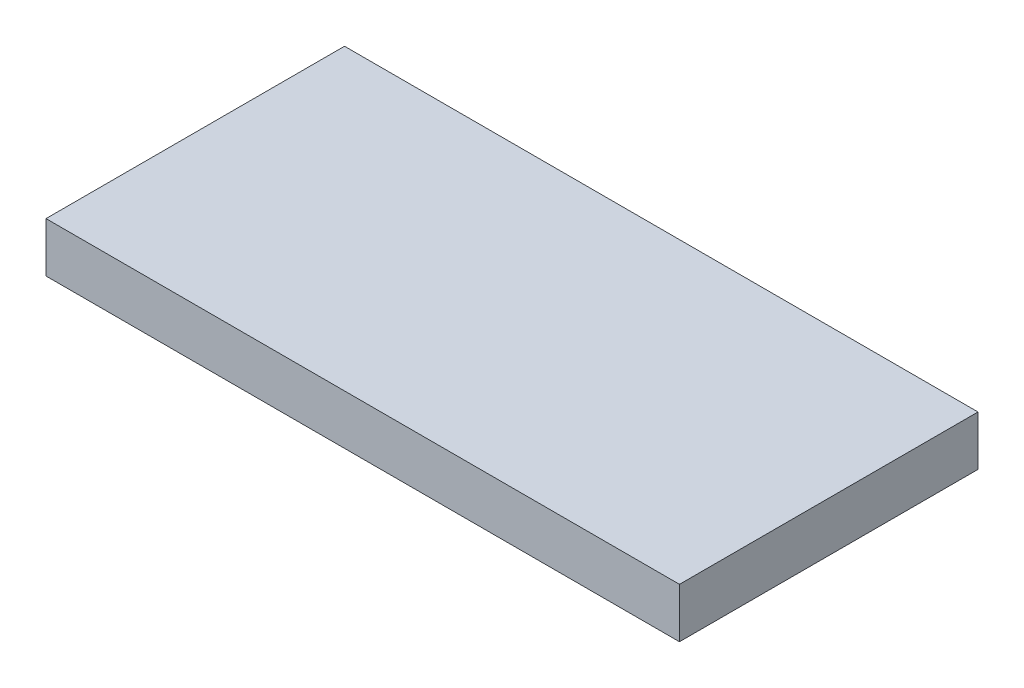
SolidWorks part; units mm, degrees
ref_plane "Front" through (0, 0, 0) normal (0, 0, 1) x (1, 0, 0)
ref_plane "Top" through (0, 0, 0) normal (0, 1, 0) x (1, 0, 0)
ref_plane "Right" through (0, 0, 0) normal (1, 0, 0) x (0, 0, -1)
sketch "Sketch1" plane through (0, 0, 0) normal (0, 1, 0) x (1, 0, 0)
  line L1 (-646.7996, 304.8) -> (646.7996, 304.8)
  line L2 (-646.7996, 304.8) -> (-646.7996, -304.8)
  line L3 (-646.7996, -304.8) -> (646.7996, -304.8)
  line L4 (646.7996, 304.8) -> (646.7996, -304.8)
  line L5 (-646.7996, 304.8) -> (646.7996, -304.8) construction
  line L6 (-646.7996, -304.8) -> (646.7996, 304.8) construction
  point P0 (0, 0)
  dimension "D1" = 609.6
  dimension "D2" = 1293.5991
extrude "Extrude1" add sketch "Sketch1" along normal mid plane 101.6
